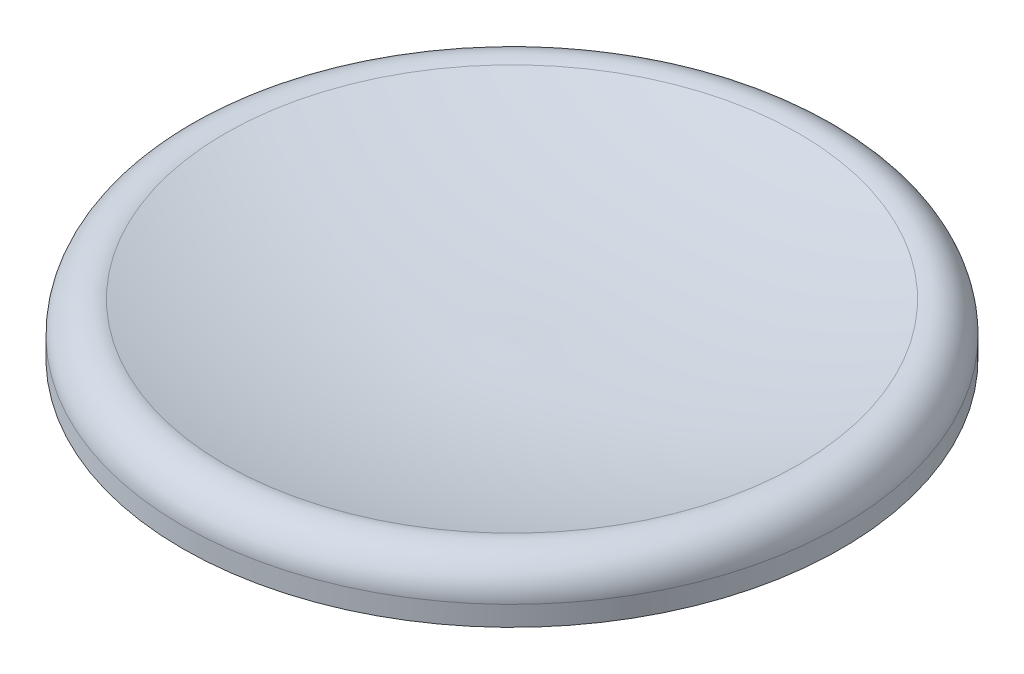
SolidWorks part; units mm, degrees
ref_plane "Front Plane" through (0, 0, 0) normal (0, 0, 1) x (1, 0, 0)
ref_plane "Top Plane" through (0, 0, 0) normal (0, 1, 0) x (1, 0, 0)
ref_plane "Right Plane" through (0, 0, 0) normal (1, 0, 0) x (0, 0, -1)
sketch "Sketch2" plane through (0, 0, 0) normal (0, 0, 1) x (1, 0, 0)
  line L0 (0, 0) -> (0, 5.7483) construction
  line L1 (0, 0) -> (4, 0)
  line L2 (4, 0) -> (4, 3)
  line L3 (4, 3) -> (10, 3)
  line L4 (10, 3) -> (10, 5)
  line L5 (0, 0) -> (0, 3.4)
  arc A0 (10, 5) -> (0, 3.4) centre (0.9709, 29.3819) cw
  point P9 (0, 3.3603)
  dimension "D4" = 26
  dimension "D1" = 4
  dimension "D2" = 3
  dimension "D3" = 2
  dimension "D5" = 10
  dimension "D6" = 3.4
revolve "Revolve1" add sketch "Sketch2" angle 360 about L0
fillet "Fillet1" radius 1 1 edges at (0, 5, -10)
